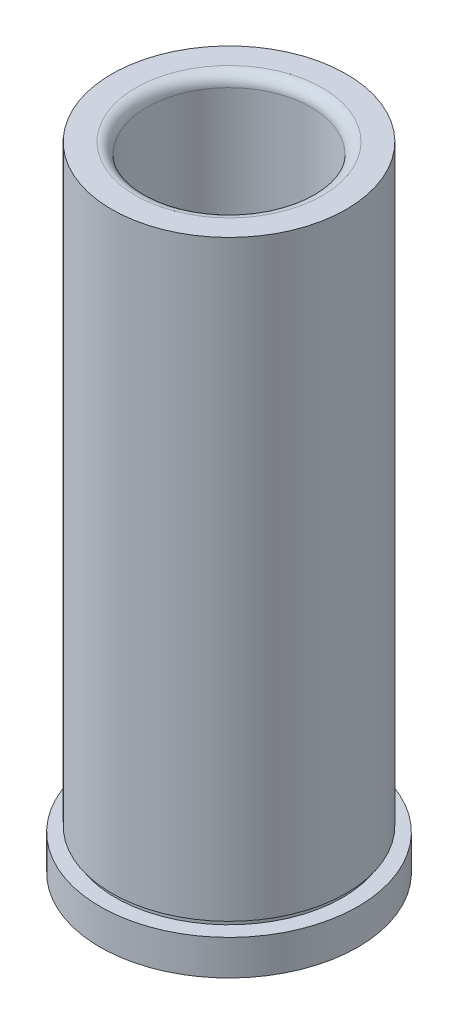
SolidWorks part; units mm, degrees
ref_plane "Front Plane" through (0, 0, 0) normal (0, 0, 1) x (1, 0, 0)
ref_plane "Top Plane" through (0, 0, 0) normal (0, 1, 0) x (1, 0, 0)
ref_plane "Right Plane" through (0, 0, 0) normal (1, 0, 0) x (0, 0, -1)
sketch "Sketch1" plane through (0, 0, 0) normal (0, 0, 1) x (1, 0, 0)
  line L0 (-736.3938, 0) -> (49263.6062, 0) construction
  line L1 (0, -1000) -> (0, 49000) construction
  line L2 (-11.1189, 85.725) -> (-11.1188, 41.275)
  line L4 (-17.4625, 0) -> (-17.4625, 4.7625)
  line L5 (-17.4625, 4.7625) -> (-15.3733, 4.7625)
  line L6 (-15.8814, 85.725) -> (-15.8813, 5.5245)
  line L7 (-15.8814, 85.725) -> (-11.1189, 85.725)
  line L9 (-12.3888, 0.7937) -> (-13.1826, 0)
  line L10 (-15.8813, 5.5245) -> (-15.3733, 5.5245)
  line L11 (-15.3733, 5.5245) -> (-15.3733, 4.7625)
  line L12 (-12.3888, 0.7937) -> (-12.3888, 40.005)
  line L13 (-13.1826, 0) -> (-17.4625, 0)
  arc A0 (-11.1188, 41.275) -> (-12.3888, 40.005) centre (-11.1189, 40.005) ccw
  dimension "D1" = 0.508
  dimension "OD" = 31.7627
  dimension "ID" = 22.2377
  dimension "FLANGETHICKNESS" = 4.7625
  dimension "FLANGEDIA" = 34.925
  dimension "D2" = 0.7938
  dimension "D3" = 0.762
  dimension "D4" = 1.27
  dimension "D5" = 85.725
  dimension "D6" = 45
  dimension "D7" = 44.45
revolve "Revolve1" add sketch "Sketch1" angle 360 about L1
fillet "Fillet1" radius 1.524 1 edges at (11.1188, 85.725, 0)
